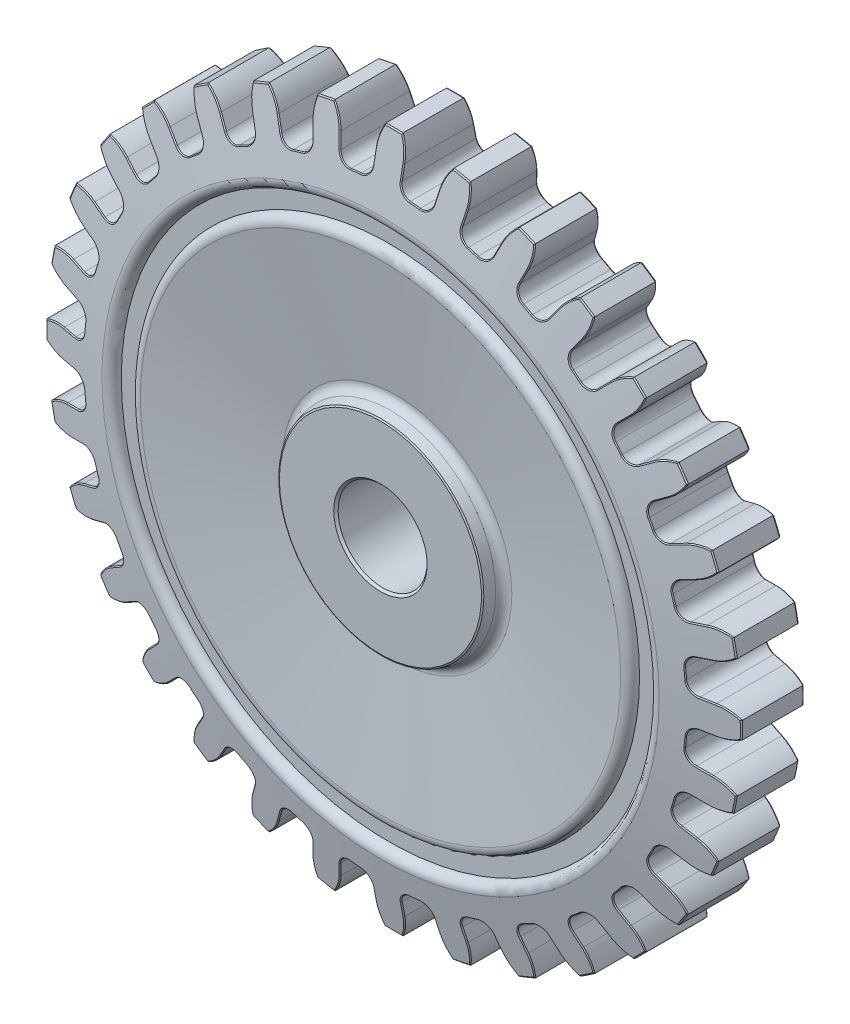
SolidWorks part; units mm, degrees
ref_plane "Спереди" through (0, 0, 0) normal (0, 0, 1) x (1, 0, 0)
ref_plane "Сверху" through (0, 0, 0) normal (0, 1, 0) x (1, 0, 0)
ref_plane "Справа" through (0, 0, 0) normal (1, 0, 0) x (0, 0, -1)
sketch "Эскиз2" plane through (0, 0, 0) normal (1, 0, 0) x (0, 0, -1)
  line L0 (-9.4803, 0) -> (8.8412, 0) construction
  line L1 (-5, 5) -> (5, 5)
  line L2 (5, 5) -> (5, 11.5)
  line L3 (-3.5, 39.1) -> (3.5, 39.1)
  line L4 (0, 0) -> (0, 39.1) construction
  line L5 (4, 30.1255) -> (4, 28.1255)
  line L6 (5, 11.5) -> (5, 38.75) construction
  line L7 (3.5, 39.1) -> (4.9824, 31.3125)
  line L8 (5, 11.5) -> (3.8613, 11.8158)
  line L9 (4.9914, 26.995) -> (3.1371, 12.9099)
  line L10 (-5, 5) -> (-5, 11.5)
  line L11 (-5, 11.5) -> (-3.8613, 11.8158)
  line L12 (-4.9914, 26.995) -> (-3.1371, 12.9099)
  line L13 (-4, 30.1255) -> (-4, 28.1255)
  line L14 (-3.5, 39.1) -> (-4.9824, 31.3125)
  arc A0 (4, 30.1255) -> (4.9824, 31.3125) centre (4, 31.1255) ccw
  arc A1 (4.9914, 26.995) -> (4, 28.1255) centre (4, 27.1255) ccw
  arc A2 (3.1371, 12.9099) -> (3.8613, 11.8158) centre (4.1286, 12.7794) ccw
  arc A3 (-3.1371, 12.9099) -> (-3.8613, 11.8158) centre (-4.1286, 12.7794) cw
  arc A4 (-4.9914, 26.995) -> (-4, 28.1255) centre (-4, 27.1255) cw
  arc A5 (-4, 30.1255) -> (-4.9824, 31.3125) centre (-4, 31.1255) cw
  point P19 (0, 5)
  dimension "D8" = 2
  dimension "D1" = 5
  dimension "D2" = 11.5
  dimension "D3" = 5
  dimension "D4" = 39.1
  dimension "D5" = 3.5
  dimension "D6" = 2
  dimension "D7" = 30.1255
  dimension "D9" = 4
  dimension "D10" = 15.5
  dimension "D11" = 7.5
  dimension "D12" = 12.7794
revolve "Повернуть1" add sketch "Эскиз2" angle 360 about L0
sketch "Эскиз3" plane through (0, 0, 0) normal (0, 0, 1) x (1, 0, 0)
  line L0 (0, 42.1478) -> (0, 0) construction
  line L2 (1.6, 36.6426) -> (1.6, 35.0778)
  line L3 (-1.6, 36.6426) -> (-1.6, 35.0778)
  line L4 (8.7179, 35.6264) -> (8.4126, 34.0916)
  line L5 (5.5794, 36.2507) -> (5.2741, 34.7159)
  line L6 (15.5007, 33.2411) -> (14.9019, 31.7954)
  line L7 (12.5443, 34.4656) -> (11.9455, 33.0199)
  line L8 (21.6879, 29.5783) -> (20.8185, 28.2772)
  line L9 (19.0272, 31.3561) -> (18.1578, 30.055)
  line L10 (27.0416, 24.7789) -> (25.9351, 23.6724)
  line L11 (24.7789, 27.0416) -> (23.6724, 25.9351)
  line L12 (31.3561, 19.0272) -> (30.055, 18.1578)
  line L13 (29.5783, 21.6879) -> (28.2772, 20.8185)
  line L14 (34.4656, 12.5443) -> (33.0199, 11.9455)
  line L15 (33.2411, 15.5007) -> (31.7954, 14.9019)
  line L16 (36.2507, 5.5794) -> (34.7159, 5.2741)
  line L17 (35.6264, 8.7179) -> (34.0916, 8.4126)
  line L18 (36.6426, -1.6) -> (35.0778, -1.6)
  line L19 (36.6426, 1.6) -> (35.0778, 1.6)
  line L20 (35.6264, -8.7179) -> (34.0916, -8.4126)
  line L21 (36.2507, -5.5794) -> (34.7159, -5.2741)
  line L22 (33.2411, -15.5007) -> (31.7954, -14.9019)
  line L23 (34.4656, -12.5443) -> (33.0199, -11.9455)
  line L24 (29.5783, -21.6879) -> (28.2772, -20.8185)
  line L25 (31.3561, -19.0272) -> (30.055, -18.1578)
  line L26 (24.7789, -27.0416) -> (23.6724, -25.9351)
  line L27 (27.0416, -24.7789) -> (25.9351, -23.6724)
  line L28 (19.0272, -31.3561) -> (18.1578, -30.055)
  line L29 (21.6879, -29.5783) -> (20.8185, -28.2772)
  line L30 (12.5443, -34.4656) -> (11.9455, -33.0199)
  line L31 (15.5007, -33.2411) -> (14.9019, -31.7954)
  line L32 (5.5794, -36.2507) -> (5.2741, -34.7159)
  line L33 (8.7179, -35.6264) -> (8.4126, -34.0916)
  line L34 (-1.6, -36.6426) -> (-1.6, -35.0778)
  line L35 (1.6, -36.6426) -> (1.6, -35.0778)
  line L36 (-8.7179, -35.6264) -> (-8.4126, -34.0916)
  line L37 (-5.5794, -36.2507) -> (-5.2741, -34.7159)
  line L38 (-15.5007, -33.2411) -> (-14.9019, -31.7954)
  line L39 (-12.5443, -34.4656) -> (-11.9455, -33.0199)
  line L40 (-21.6879, -29.5783) -> (-20.8185, -28.2772)
  line L41 (-19.0272, -31.3561) -> (-18.1578, -30.055)
  line L42 (-27.0416, -24.7789) -> (-25.9351, -23.6724)
  line L43 (-24.7789, -27.0416) -> (-23.6724, -25.9351)
  line L44 (-31.3561, -19.0272) -> (-30.055, -18.1578)
  line L45 (-29.5783, -21.6879) -> (-28.2772, -20.8185)
  line L46 (-34.4656, -12.5443) -> (-33.0199, -11.9455)
  line L47 (-33.2411, -15.5007) -> (-31.7954, -14.9019)
  line L48 (-36.2507, -5.5794) -> (-34.7159, -5.2741)
  line L49 (-35.6264, -8.7179) -> (-34.0916, -8.4126)
  line L50 (-36.6426, 1.6) -> (-35.0778, 1.6)
  line L51 (-36.6426, -1.6) -> (-35.0778, -1.6)
  line L52 (-35.6264, 8.7179) -> (-34.0916, 8.4126)
  line L53 (-36.2507, 5.5794) -> (-34.7159, 5.2741)
  line L54 (-33.2411, 15.5007) -> (-31.7954, 14.9019)
  line L55 (-34.4656, 12.5443) -> (-33.0199, 11.9455)
  line L56 (-29.5783, 21.6879) -> (-28.2772, 20.8185)
  line L57 (-31.3561, 19.0272) -> (-30.055, 18.1578)
  line L58 (-24.7789, 27.0416) -> (-23.6724, 25.9351)
  line L59 (-27.0416, 24.7789) -> (-25.9351, 23.6724)
  line L60 (-19.0272, 31.3561) -> (-18.1578, 30.055)
  line L61 (-21.6879, 29.5783) -> (-20.8185, 28.2772)
  line L62 (-12.5443, 34.4656) -> (-11.9455, 33.0199)
  line L63 (-15.5007, 33.2411) -> (-14.9019, 31.7954)
  line L64 (-5.5794, 36.2507) -> (-5.2741, 34.7159)
  line L65 (-8.7179, 35.6264) -> (-8.4126, 34.0916)
  circle A0 centre (0, 0) radius 36.8 construction
  arc A1 (-9.3097, 32.6226) -> (-10.3834, 32.2969) centre (0, 0) ccw
  circle A2 centre (0, 0) radius 39.1 construction
  arc A3 (0.9611, 39.0882) -> (1.6, 36.6426) centre (-3.4, 36.6426) cw
  arc A4 (0.9611, 39.0882) -> (-0.9611, 39.0882) centre (0, 0) ccw
  arc A5 (-0.9611, 39.0882) -> (-1.6, 36.6426) centre (3.4, 36.6426) ccw
  arc A6 (8.5683, 38.1496) -> (8.7179, 35.6264) centre (3.8139, 36.6018) cw
  arc A7 (8.5683, 38.1496) -> (6.6831, 38.5246) centre (0, 0) ccw
  arc A8 (6.6831, 38.5246) -> (5.5794, 36.2507) centre (10.4833, 35.2752) ccw
  arc A9 (15.8463, 35.745) -> (15.5007, 33.2411) centre (10.8813, 35.1545) cw
  arc A10 (15.8463, 35.745) -> (14.0705, 36.4806) centre (0, 0) ccw
  arc A11 (14.0705, 36.4806) -> (12.5443, 34.4656) centre (17.1637, 32.5522) ccw
  arc A12 (22.5153, 31.9667) -> (21.6879, 29.5783) centre (17.5305, 32.3561) cw
  arc A13 (22.5153, 31.9667) -> (20.9171, 33.0346) centre (0, 0) ccw
  arc A14 (20.9171, 33.0346) -> (19.0272, 31.3561) centre (23.1845, 28.5783) ccw
  arc A15 (28.3191, 26.9599) -> (27.0416, 24.7789) centre (23.5061, 28.3144) cw
  arc A16 (28.3191, 26.9599) -> (26.9599, 28.3191) centre (0, 0) ccw
  arc A17 (26.9599, 28.3191) -> (24.7789, 27.0416) centre (28.3144, 23.5061) ccw
  arc A18 (33.0346, 20.9171) -> (31.3561, 19.0272) centre (28.5783, 23.1845) cw
  arc A19 (33.0346, 20.9171) -> (31.9667, 22.5153) centre (0, 0) ccw
  arc A20 (31.9667, 22.5153) -> (29.5783, 21.6879) centre (32.3561, 17.5305) ccw
  arc A21 (36.4806, 14.0705) -> (34.4656, 12.5443) centre (32.5522, 17.1637) cw
  arc A22 (36.4806, 14.0705) -> (35.745, 15.8463) centre (0, 0) ccw
  arc A23 (35.745, 15.8463) -> (33.2411, 15.5007) centre (35.1545, 10.8813) ccw
  arc A24 (38.5246, 6.6831) -> (36.2507, 5.5794) centre (35.2752, 10.4833) cw
  arc A25 (38.5246, 6.6831) -> (38.1496, 8.5683) centre (0, 0) ccw
  arc A26 (38.1496, 8.5683) -> (35.6264, 8.7179) centre (36.6018, 3.8139) ccw
  arc A27 (39.0882, -0.9611) -> (36.6426, -1.6) centre (36.6426, 3.4) cw
  arc A28 (39.0882, -0.9611) -> (39.0882, 0.9611) centre (0, 0) ccw
  arc A29 (39.0882, 0.9611) -> (36.6426, 1.6) centre (36.6426, -3.4) ccw
  arc A30 (38.1496, -8.5683) -> (35.6264, -8.7179) centre (36.6018, -3.8139) cw
  arc A31 (38.1496, -8.5683) -> (38.5246, -6.6831) centre (0, 0) ccw
  arc A32 (38.5246, -6.6831) -> (36.2507, -5.5794) centre (35.2752, -10.4833) ccw
  arc A33 (35.745, -15.8463) -> (33.2411, -15.5007) centre (35.1545, -10.8813) cw
  arc A34 (35.745, -15.8463) -> (36.4806, -14.0705) centre (0, 0) ccw
  arc A35 (36.4806, -14.0705) -> (34.4656, -12.5443) centre (32.5522, -17.1637) ccw
  arc A36 (31.9667, -22.5153) -> (29.5783, -21.6879) centre (32.3561, -17.5305) cw
  arc A37 (31.9667, -22.5153) -> (33.0346, -20.9171) centre (0, 0) ccw
  arc A38 (33.0346, -20.9171) -> (31.3561, -19.0272) centre (28.5783, -23.1845) ccw
  arc A39 (26.9599, -28.3191) -> (24.7789, -27.0416) centre (28.3144, -23.5061) cw
  arc A40 (26.9599, -28.3191) -> (28.3191, -26.9599) centre (0, 0) ccw
  arc A41 (28.3191, -26.9599) -> (27.0416, -24.7789) centre (23.5061, -28.3144) ccw
  arc A42 (20.9171, -33.0346) -> (19.0272, -31.3561) centre (23.1845, -28.5783) cw
  arc A43 (20.9171, -33.0346) -> (22.5153, -31.9667) centre (0, 0) ccw
  arc A44 (22.5153, -31.9667) -> (21.6879, -29.5783) centre (17.5305, -32.3561) ccw
  arc A45 (14.0705, -36.4806) -> (12.5443, -34.4656) centre (17.1637, -32.5522) cw
  arc A46 (14.0705, -36.4806) -> (15.8463, -35.745) centre (0, 0) ccw
  arc A47 (15.8463, -35.745) -> (15.5007, -33.2411) centre (10.8813, -35.1545) ccw
  arc A48 (6.6831, -38.5246) -> (5.5794, -36.2507) centre (10.4833, -35.2752) cw
  arc A49 (6.6831, -38.5246) -> (8.5683, -38.1496) centre (0, 0) ccw
  arc A50 (8.5683, -38.1496) -> (8.7179, -35.6264) centre (3.8139, -36.6018) ccw
  arc A51 (-0.9611, -39.0882) -> (-1.6, -36.6426) centre (3.4, -36.6426) cw
  arc A52 (-0.9611, -39.0882) -> (0.9611, -39.0882) centre (0, 0) ccw
  arc A53 (0.9611, -39.0882) -> (1.6, -36.6426) centre (-3.4, -36.6426) ccw
  arc A54 (-8.5683, -38.1496) -> (-8.7179, -35.6264) centre (-3.8139, -36.6018) cw
  arc A55 (-8.5683, -38.1496) -> (-6.6831, -38.5246) centre (0, 0) ccw
  arc A56 (-6.6831, -38.5246) -> (-5.5794, -36.2507) centre (-10.4833, -35.2752) ccw
  arc A57 (-15.8463, -35.745) -> (-15.5007, -33.2411) centre (-10.8813, -35.1545) cw
  arc A58 (-15.8463, -35.745) -> (-14.0705, -36.4806) centre (0, 0) ccw
  arc A59 (-14.0705, -36.4806) -> (-12.5443, -34.4656) centre (-17.1637, -32.5522) ccw
  arc A60 (-22.5153, -31.9667) -> (-21.6879, -29.5783) centre (-17.5305, -32.3561) cw
  arc A61 (-22.5153, -31.9667) -> (-20.9171, -33.0346) centre (0, 0) ccw
  arc A62 (-20.9171, -33.0346) -> (-19.0272, -31.3561) centre (-23.1845, -28.5783) ccw
  arc A63 (-28.3191, -26.9599) -> (-27.0416, -24.7789) centre (-23.5061, -28.3144) cw
  arc A64 (-28.3191, -26.9599) -> (-26.9599, -28.3191) centre (0, 0) ccw
  arc A65 (-26.9599, -28.3191) -> (-24.7789, -27.0416) centre (-28.3144, -23.5061) ccw
  arc A66 (-33.0346, -20.9171) -> (-31.3561, -19.0272) centre (-28.5783, -23.1845) cw
  arc A67 (-33.0346, -20.9171) -> (-31.9667, -22.5153) centre (0, 0) ccw
  arc A68 (-31.9667, -22.5153) -> (-29.5783, -21.6879) centre (-32.3561, -17.5305) ccw
  arc A69 (-36.4806, -14.0705) -> (-34.4656, -12.5443) centre (-32.5522, -17.1637) cw
  arc A70 (-36.4806, -14.0705) -> (-35.745, -15.8463) centre (0, 0) ccw
  arc A71 (-35.745, -15.8463) -> (-33.2411, -15.5007) centre (-35.1545, -10.8813) ccw
  arc A72 (-38.5246, -6.6831) -> (-36.2507, -5.5794) centre (-35.2752, -10.4833) cw
  arc A73 (-38.5246, -6.6831) -> (-38.1496, -8.5683) centre (0, 0) ccw
  arc A74 (-38.1496, -8.5683) -> (-35.6264, -8.7179) centre (-36.6018, -3.8139) ccw
  arc A75 (-39.0882, 0.9611) -> (-36.6426, 1.6) centre (-36.6426, -3.4) cw
  arc A76 (-39.0882, 0.9611) -> (-39.0882, -0.9611) centre (0, 0) ccw
  arc A77 (-39.0882, -0.9611) -> (-36.6426, -1.6) centre (-36.6426, 3.4) ccw
  arc A78 (-38.1496, 8.5683) -> (-35.6264, 8.7179) centre (-36.6018, 3.8139) cw
  arc A79 (-38.1496, 8.5683) -> (-38.5246, 6.6831) centre (0, 0) ccw
  arc A80 (-38.5246, 6.6831) -> (-36.2507, 5.5794) centre (-35.2752, 10.4833) ccw
  arc A81 (-35.745, 15.8463) -> (-33.2411, 15.5007) centre (-35.1545, 10.8813) cw
  arc A82 (-35.745, 15.8463) -> (-36.4806, 14.0705) centre (0, 0) ccw
  arc A83 (-36.4806, 14.0705) -> (-34.4656, 12.5443) centre (-32.5522, 17.1637) ccw
  arc A84 (-31.9667, 22.5153) -> (-29.5783, 21.6879) centre (-32.3561, 17.5305) cw
  arc A85 (-31.9667, 22.5153) -> (-33.0346, 20.9171) centre (0, 0) ccw
  arc A86 (-33.0346, 20.9171) -> (-31.3561, 19.0272) centre (-28.5783, 23.1845) ccw
  arc A87 (-26.9599, 28.3191) -> (-24.7789, 27.0416) centre (-28.3144, 23.5061) cw
  arc A88 (-26.9599, 28.3191) -> (-28.3191, 26.9599) centre (0, 0) ccw
  arc A89 (-28.3191, 26.9599) -> (-27.0416, 24.7789) centre (-23.5061, 28.3144) ccw
  arc A90 (-20.9171, 33.0346) -> (-19.0272, 31.3561) centre (-23.1845, 28.5783) cw
  arc A91 (-20.9171, 33.0346) -> (-22.5153, 31.9667) centre (0, 0) ccw
  arc A92 (-22.5153, 31.9667) -> (-21.6879, 29.5783) centre (-17.5305, 32.3561) ccw
  arc A93 (-14.0705, 36.4806) -> (-12.5443, 34.4656) centre (-17.1637, 32.5522) cw
  arc A94 (-14.0705, 36.4806) -> (-15.8463, 35.745) centre (0, 0) ccw
  arc A95 (-15.8463, 35.745) -> (-15.5007, 33.2411) centre (-10.8813, 35.1545) ccw
  arc A96 (-6.6831, 38.5246) -> (-5.5794, 36.2507) centre (-10.4833, 35.2752) cw
  arc A97 (-6.6831, 38.5246) -> (-8.5683, 38.1496) centre (0, 0) ccw
  arc A98 (-8.5683, 38.1496) -> (-8.7179, 35.6264) centre (-3.8139, 36.6018) ccw
  arc A99 (-2.7664, 33.812) -> (-3.8831, 33.702) centre (0, 0) ccw
  arc A100 (3.8831, 33.702) -> (2.7664, 33.812) centre (0, 0) ccw
  arc A101 (10.3834, 32.2969) -> (9.3097, 32.6226) centre (0, 0) ccw
  arc A102 (16.4847, 29.6506) -> (15.4952, 30.1796) centre (0, 0) ccw
  arc A103 (21.9525, 25.8649) -> (21.0852, 26.5767) centre (0, 0) ccw
  arc A104 (26.5767, 21.0852) -> (25.8649, 21.9525) centre (0, 0) ccw
  arc A105 (30.1796, 15.4952) -> (29.6506, 16.4847) centre (0, 0) ccw
  arc A106 (32.6226, 9.3097) -> (32.2969, 10.3834) centre (0, 0) ccw
  arc A107 (33.812, 2.7664) -> (33.702, 3.8831) centre (0, 0) ccw
  arc A108 (33.702, -3.8831) -> (33.812, -2.7664) centre (0, 0) ccw
  arc A109 (32.2969, -10.3834) -> (32.6226, -9.3097) centre (0, 0) ccw
  arc A110 (29.6506, -16.4847) -> (30.1796, -15.4952) centre (0, 0) ccw
  arc A111 (25.8649, -21.9525) -> (26.5767, -21.0852) centre (0, 0) ccw
  arc A112 (21.0852, -26.5767) -> (21.9525, -25.8649) centre (0, 0) ccw
  arc A113 (15.4952, -30.1796) -> (16.4847, -29.6506) centre (0, 0) ccw
  arc A114 (9.3097, -32.6226) -> (10.3834, -32.2969) centre (0, 0) ccw
  arc A115 (2.7664, -33.812) -> (3.8831, -33.702) centre (0, 0) ccw
  arc A116 (-3.8831, -33.702) -> (-2.7664, -33.812) centre (0, 0) ccw
  arc A117 (-10.3834, -32.2969) -> (-9.3097, -32.6226) centre (0, 0) ccw
  arc A118 (-16.4847, -29.6506) -> (-15.4952, -30.1796) centre (0, 0) ccw
  arc A119 (-21.9525, -25.8649) -> (-21.0852, -26.5767) centre (0, 0) ccw
  arc A120 (-26.5767, -21.0852) -> (-25.8649, -21.9525) centre (0, 0) ccw
  arc A121 (-30.1796, -15.4952) -> (-29.6506, -16.4847) centre (0, 0) ccw
  arc A122 (-32.6226, -9.3097) -> (-32.2969, -10.3834) centre (0, 0) ccw
  arc A123 (-33.812, -2.7664) -> (-33.702, -3.8831) centre (0, 0) ccw
  arc A124 (-33.702, 3.8831) -> (-33.812, 2.7664) centre (0, 0) ccw
  arc A125 (-32.2969, 10.3834) -> (-32.6226, 9.3097) centre (0, 0) ccw
  arc A126 (-29.6506, 16.4847) -> (-30.1796, 15.4952) centre (0, 0) ccw
  arc A127 (-25.8649, 21.9525) -> (-26.5767, 21.0852) centre (0, 0) ccw
  arc A128 (-21.0852, 26.5767) -> (-21.9525, 25.8649) centre (0, 0) ccw
  arc A129 (-15.4952, 30.1796) -> (-16.4847, 29.6506) centre (0, 0) ccw
  arc A130 (20.8185, -28.2772) -> (21.0852, -26.5767) centre (21.8745, -27.5716) cw
  arc A131 (23.6724, -25.9351) -> (21.9525, -25.8649) centre (22.7743, -26.8331) ccw
  arc A132 (18.1578, -30.055) -> (16.4847, -29.6506) centre (17.1019, -30.7606) ccw
  arc A133 (14.9019, -31.7954) -> (15.4952, -30.1796) centre (16.0752, -31.3093) cw
  arc A134 (8.4126, -34.0916) -> (9.3097, -32.6226) centre (9.6582, -33.8439) cw
  arc A135 (11.9455, -33.0199) -> (10.3834, -32.2969) centre (10.7722, -33.506) ccw
  arc A136 (5.2741, -34.7159) -> (3.8831, -33.702) centre (4.0285, -34.9637) ccw
  arc A137 (1.6, -35.0778) -> (2.7664, -33.812) centre (2.87, -35.0778) cw
  arc A138 (-1.6, -35.0778) -> (-2.7664, -33.812) centre (-2.87, -35.0778) ccw
  arc A139 (-5.2741, -34.7159) -> (-3.8831, -33.702) centre (-4.0285, -34.9637) cw
  arc A140 (-8.4126, -34.0916) -> (-9.3097, -32.6226) centre (-9.6582, -33.8439) ccw
  arc A141 (-11.9455, -33.0199) -> (-10.3834, -32.2969) centre (-10.7722, -33.506) cw
  arc A142 (-14.9019, -31.7954) -> (-15.4952, -30.1796) centre (-16.0752, -31.3093) ccw
  arc A143 (-18.1578, -30.055) -> (-16.4847, -29.6506) centre (-17.1019, -30.7606) cw
  arc A144 (-20.8185, -28.2772) -> (-21.0852, -26.5767) centre (-21.8745, -27.5716) ccw
  arc A145 (-23.6724, -25.9351) -> (-21.9525, -25.8649) centre (-22.7743, -26.8331) cw
  arc A146 (-25.9351, -23.6724) -> (-25.8649, -21.9525) centre (-26.8331, -22.7743) ccw
  arc A147 (-28.2772, -20.8185) -> (-26.5767, -21.0852) centre (-27.5716, -21.8745) cw
  arc A148 (-30.055, -18.1578) -> (-29.6506, -16.4847) centre (-30.7606, -17.1019) ccw
  arc A149 (-31.7954, -14.9019) -> (-30.1796, -15.4952) centre (-31.3093, -16.0752) cw
  arc A150 (-33.0199, -11.9455) -> (-32.2969, -10.3834) centre (-33.506, -10.7722) ccw
  arc A151 (-34.0916, -8.4126) -> (-32.6226, -9.3097) centre (-33.8439, -9.6582) cw
  arc A152 (-34.7159, -5.2741) -> (-33.702, -3.8831) centre (-34.9637, -4.0285) ccw
  arc A153 (-35.0778, -1.6) -> (-33.812, -2.7664) centre (-35.0778, -2.87) cw
  arc A154 (-35.0778, 1.6) -> (-33.812, 2.7664) centre (-35.0778, 2.87) ccw
  arc A155 (-34.7159, 5.2741) -> (-33.702, 3.8831) centre (-34.9637, 4.0285) cw
  arc A156 (-34.0916, 8.4126) -> (-32.6226, 9.3097) centre (-33.8439, 9.6582) ccw
  arc A157 (-33.0199, 11.9455) -> (-32.2969, 10.3834) centre (-33.506, 10.7722) cw
  arc A158 (-31.7954, 14.9019) -> (-30.1796, 15.4952) centre (-31.3093, 16.0752) ccw
  arc A159 (-30.055, 18.1578) -> (-29.6506, 16.4847) centre (-30.7606, 17.1019) cw
  arc A160 (-28.2772, 20.8185) -> (-26.5767, 21.0852) centre (-27.5716, 21.8745) ccw
  arc A161 (-25.9351, 23.6724) -> (-25.8649, 21.9525) centre (-26.8331, 22.7743) cw
  arc A162 (-20.8185, 28.2772) -> (-21.0852, 26.5767) centre (-21.8745, 27.5716) cw
  arc A163 (-23.6724, 25.9351) -> (-21.9525, 25.8649) centre (-22.7743, 26.8331) ccw
  arc A164 (25.9351, -23.6724) -> (25.8649, -21.9525) centre (26.8331, -22.7743) cw
  arc A165 (28.2772, -20.8185) -> (26.5767, -21.0852) centre (27.5716, -21.8745) ccw
  arc A166 (30.055, -18.1578) -> (29.6506, -16.4847) centre (30.7606, -17.1019) cw
  arc A167 (31.7954, -14.9019) -> (30.1796, -15.4952) centre (31.3093, -16.0752) ccw
  arc A168 (33.0199, -11.9455) -> (32.2969, -10.3834) centre (33.506, -10.7722) cw
  arc A169 (34.0916, -8.4126) -> (32.6226, -9.3097) centre (33.8439, -9.6582) ccw
  arc A170 (34.7159, -5.2741) -> (33.702, -3.8831) centre (34.9637, -4.0285) cw
  arc A171 (35.0778, -1.6) -> (33.812, -2.7664) centre (35.0778, -2.87) ccw
  arc A172 (35.0778, 1.6) -> (33.812, 2.7664) centre (35.0778, 2.87) cw
  arc A173 (34.7159, 5.2741) -> (33.702, 3.8831) centre (34.9637, 4.0285) ccw
  arc A174 (34.0916, 8.4126) -> (32.6226, 9.3097) centre (33.8439, 9.6582) cw
  arc A175 (33.0199, 11.9455) -> (32.2969, 10.3834) centre (33.506, 10.7722) ccw
  arc A176 (31.7954, 14.9019) -> (30.1796, 15.4952) centre (31.3093, 16.0752) cw
  arc A177 (30.055, 18.1578) -> (29.6506, 16.4847) centre (30.7606, 17.1019) ccw
  arc A178 (28.2772, 20.8185) -> (26.5767, 21.0852) centre (27.5716, 21.8745) cw
  arc A179 (25.9351, 23.6724) -> (25.8649, 21.9525) centre (26.8331, 22.7743) ccw
  arc A180 (23.6724, 25.9351) -> (21.9525, 25.8649) centre (22.7743, 26.8331) cw
  arc A181 (20.8185, 28.2772) -> (21.0852, 26.5767) centre (21.8745, 27.5716) ccw
  arc A182 (18.1578, 30.055) -> (16.4847, 29.6506) centre (17.1019, 30.7606) cw
  arc A183 (14.9019, 31.7954) -> (15.4952, 30.1796) centre (16.0752, 31.3093) ccw
  arc A184 (11.9455, 33.0199) -> (10.3834, 32.2969) centre (10.7722, 33.506) cw
  arc A185 (8.4126, 34.0916) -> (9.3097, 32.6226) centre (9.6582, 33.8439) ccw
  arc A186 (1.6, 35.0778) -> (2.7664, 33.812) centre (2.87, 35.0778) ccw
  arc A187 (5.2741, 34.7159) -> (3.8831, 33.702) centre (4.0285, 34.9637) cw
  arc A188 (-18.1578, 30.055) -> (-16.4847, 29.6506) centre (-17.1019, 30.7606) ccw
  arc A189 (-14.9019, 31.7954) -> (-15.4952, 30.1796) centre (-16.0752, 31.3093) cw
  arc A190 (-11.9455, 33.0199) -> (-10.3834, 32.2969) centre (-10.7722, 33.506) ccw
  arc A191 (-8.4126, 34.0916) -> (-9.3097, 32.6226) centre (-9.6582, 33.8439) cw
  arc A192 (-5.2741, 34.7159) -> (-3.8831, 33.702) centre (-4.0285, 34.9637) ccw
  arc A193 (-2.7664, 33.812) -> (-1.6, 35.0778) centre (-2.87, 35.0778) ccw
  point P406 (1.6, 33.8872)
  point P421 (-1.6, 33.8872)
  dimension "D1" = 73.6
  dimension "D3" = 1.6
  dimension "D4" = 67.85
  dimension "D6" = 1.27
  dimension "D2" = 5
  dimension "D7" = 32
extrude "Вырез-Вытянуть1" cut sketch "Эскиз3" against normal mid plane 10 flip side to cut
chamfer "Фаска1" distance 0.25 angle 45 2 edges at (5, 0, 5) (5, 0, -5)
chamfer "Фаска2" distance 0.1 angle 45 400 edges at (21.7228, -32.5105, -3.5) (22.0951, -30.3153, -3.8021) (20.6103, -27.45, -4.4087) (21.5218, -26.2244, -4.4851) (22.723, -25.5642, -4.4321) (26.1691, -28.0225, -3.6444) (27.6479, -27.6479, -3.5) (27.5847, -25.4222, -3.8021) (25.5695, -22.9017, -4.4087) (26.2244, -21.5218, -4.4851) (27.2737, -20.6399, -4.4321) (31.1333, -22.3787, -3.6443) (32.5105, -21.7228, -3.5) (32.0143, -19.5523, -3.8021) (29.5461, -17.4732, -4.4087) (29.9192, -15.9921, -4.4851) (30.7763, -14.9225, -4.4321) (34.9009, -15.8749, -3.6443) (36.1237, -14.9629, -3.5) (35.2137, -12.9309, -3.8021) (32.3872, -11.3733, -4.4087) (32.4642, -9.8479, -4.4851) (33.0962, -8.6316, -4.4321) (37.3274, -8.761, -3.6443) (38.3487, -7.628, -3.5) (37.0597, -5.8126, -3.8021) (33.9837, -4.8363, -4.4087) (33.7616, -3.3252, -4.4851) (34.1442, -2.009, -4.4321) (38.3193, -1.3105, -3.6443) (39.1, 0, -3.5) (37.4816, 1.5291, -3.8021) (34.2743, 1.8865, -4.4087) (33.7616, 3.3252, -4.4851) (33.8801, 4.6908, -4.4321) (37.8387, 6.1904, -3.6443) (38.3487, 7.628, -3.5) (36.4631, 8.812, -3.8021) (33.2477, 8.5368, -4.4087) (32.4642, 9.8479, -4.4851) (32.3139, 11.2104, -4.4321) (35.9039, 13.4534, -3.6443) (36.1237, 14.9629, -3.5) (34.0433, 15.7563, -3.8021) (30.9434, 14.8591, -4.4087) (29.9192, 15.9921, -4.4851) (29.506, 17.2991, -4.4321) (32.5894, 20.1994, -3.6443) (32.5105, 21.7228, -3.5) (30.3153, 22.0951, -3.8021) (27.45, 20.6103, -4.4087) (26.2244, 21.5218, -4.4851) (25.5642, 22.723, -4.4321) (28.0225, 26.1691, -3.6444) (27.6479, 27.6479, -3.5) (25.4222, 27.5847, -3.8021) (22.9017, 25.5695, -4.4087) (21.5218, 26.2244, -4.4851) (20.6399, 27.2737, -4.4321) (22.3787, 31.1333, -3.6443) (21.7228, 32.5105, -3.5) (19.5523, 32.0143, -3.8021) (17.4732, 29.5461, -4.4087) (15.9921, 29.9192, -4.4851) (14.9225, 30.7763, -4.4321) (15.8749, 34.9009, -3.6443) (14.9629, 36.1237, -3.5) (12.9309, 35.2137, -3.8021) (11.3733, 32.3872, -4.4087) (9.8479, 32.4642, -4.4851) (8.6316, 33.0962, -4.4321) (8.761, 37.3274, -3.6443) (7.628, 38.3487, -3.5) (5.8126, 37.0597, -3.8021) (4.8363, 33.9837, -4.4087) (3.3252, 33.7616, -4.4851) (2.009, 34.1442, -4.4321) (1.3105, 38.3193, -3.6443) (0, 39.1, -3.5) (-1.5291, 37.4816, -3.8021) (-1.8865, 34.2743, -4.4087) (-3.3252, 33.7616, -4.4851) (-4.6908, 33.8801, -4.4321) (-6.1904, 37.8387, -3.6443) (-7.628, 38.3487, -3.5) (-8.812, 36.4631, -3.8021) (-8.5368, 33.2477, -4.4087) (-9.8479, 32.4642, -4.4851) (-11.2104, 32.3139, -4.4321) (-13.4534, 35.9039, -3.6443) (-14.9629, 36.1237, -3.5) (-15.7563, 34.0433, -3.8021) (-14.8591, 30.9434, -4.4087) (-15.9921, 29.9192, -4.4851) (-17.2991, 29.506, -4.4321) (-20.1994, 32.5894, -3.6443) (-21.7228, 32.5105, -3.5) (-22.0951, 30.3153, -3.8021) (-20.6103, 27.45, -4.4087) (-21.5218, 26.2244, -4.4851) (-22.723, 25.5642, -4.4321) (-26.1691, 28.0225, -3.6444) (-27.6479, 27.6479, -3.5) (-27.5847, 25.4222, -3.8021) (-25.5695, 22.9017, -4.4087) (-26.2244, 21.5218, -4.4851) (-27.2737, 20.6399, -4.4321) (-31.1333, 22.3787, -3.6443) (-32.5105, 21.7228, -3.5) (-32.0143, 19.5523, -3.8021) (-29.5461, 17.4732, -4.4087) (-29.9192, 15.9921, -4.4851) (-30.7763, 14.9225, -4.4321) (-34.9009, 15.8749, -3.6443) (-36.1237, 14.9629, -3.5) (-35.2137, 12.9309, -3.8021) (-32.3872, 11.3733, -4.4087) (-32.4642, 9.8479, -4.4851) (-33.0962, 8.6316, -4.4321) (-37.3274, 8.761, -3.6443) (-38.3487, 7.628, -3.5) (-37.0597, 5.8126, -3.8021) (-33.9837, 4.8363, -4.4087) (-33.7616, 3.3252, -4.4851) (-34.1442, 2.009, -4.4321) (-38.3193, 1.3105, -3.6443) (-39.1, 0, -3.5) (-37.4816, -1.5291, -3.8021) (-34.2743, -1.8865, -4.4087) (-33.7616, -3.3252, -4.4851) (-33.8801, -4.6908, -4.4321) (-37.8387, -6.1904, -3.6443) (-38.3487, -7.628, -3.5) (-36.4631, -8.812, -3.8021) (-33.2477, -8.5368, -4.4087) (-32.4642, -9.8479, -4.4851) (-32.3139, -11.2104, -4.4321) (-35.9039, -13.4534, -3.6443) (-36.1237, -14.9629, -3.5) (-34.0433, -15.7563, -3.8021) (-30.9434, -14.8591, -4.4087) (-29.9192, -15.9921, -4.4851) (-29.506, -17.2991, -4.4321) (-32.5894, -20.1994, -3.6443) (-32.5105, -21.7228, -3.5) (-30.3153, -22.0951, -3.8021) (-27.45, -20.6103, -4.4087) (-26.2244, -21.5218, -4.4851) (-25.5642, -22.723, -4.4321) (-28.0225, -26.1691, -3.6444) (-27.6479, -27.6479, -3.5) (-25.4222, -27.5847, -3.8021) (-22.9017, -25.5695, -4.4087) (-21.5218, -26.2244, -4.4851) (-20.6399, -27.2737, -4.4321) (-22.3787, -31.1333, -3.6443) (-21.7228, -32.5105, -3.5) (-19.5523, -32.0143, -3.8021) (-17.4732, -29.5461, -4.4087) (-15.9921, -29.9192, -4.4851) (-14.9225, -30.7763, -4.4321) (-15.8749, -34.9009, -3.6443) (-14.9629, -36.1237, -3.5) (-12.9309, -35.2137, -3.8021) (-11.3733, -32.3872, -4.4087) (-9.8479, -32.4642, -4.4851) (-8.6316, -33.0962, -4.4321) (-8.761, -37.3274, -3.6443) (-7.628, -38.3487, -3.5) (-5.8126, -37.0597, -3.8021) (-4.8363, -33.9837, -4.4087) (-3.3252, -33.7616, -4.4851) (-2.009, -34.1442, -4.4321) (-1.3105, -38.3193, -3.6443) (0, -39.1, -3.5) (1.5291, -37.4816, -3.8021) (1.8865, -34.2743, -4.4087) (3.3252, -33.7616, -4.4851) (4.6908, -33.8801, -4.4321) (6.1904, -37.8387, -3.6443) (7.628, -38.3487, -3.5) (8.812, -36.4631, -3.8021) (8.5368, -33.2477, -4.4087) (9.8479, -32.4642, -4.4851) (11.2104, -32.3139, -4.4321) (13.4534, -35.9039, -3.6443) (14.9629, -36.1237, -3.5) (15.7563, -34.0433, -3.8021) (14.8591, -30.9434, -4.4087) (15.9921, -29.9192, -4.4851) (17.2991, -29.506, -4.4321) (20.1994, -32.5894, -3.6443) (14.9629, -36.1237, 3.5) (12.9309, -35.2137, 3.8021) (11.3733, -32.3872, 4.4087) (9.8479, -32.4642, 4.4851) (8.6316, -33.0962, 4.4321) (8.761, -37.3274, 3.6443) (7.628, -38.3487, 3.5) (5.8126, -37.0597, 3.8021) (4.8363, -33.9837, 4.4087) (3.3252, -33.7616, 4.4851) (2.009, -34.1442, 4.4321) (1.3105, -38.3193, 3.6443) (0, -39.1, 3.5) (-1.5291, -37.4816, 3.8021) (-1.8865, -34.2743, 4.4087) (-3.3252, -33.7616, 4.4851) (-4.6908, -33.8801, 4.4321) (-6.1904, -37.8387, 3.6443) (-7.628, -38.3487, 3.5) (-8.812, -36.4631, 3.8021) (-8.5368, -33.2477, 4.4087) (-9.8479, -32.4642, 4.4851) (-11.2104, -32.3139, 4.4321) (-13.4534, -35.9039, 3.6443) (-14.9629, -36.1237, 3.5) (-15.7563, -34.0433, 3.8021) (-14.8591, -30.9434, 4.4087) (-15.9921, -29.9192, 4.4851) (-17.2991, -29.506, 4.4321) (-20.1994, -32.5894, 3.6443) (-21.7228, -32.5105, 3.5) (-22.0951, -30.3153, 3.8021) (-20.6103, -27.45, 4.4087) (-21.5218, -26.2244, 4.4851) (-22.723, -25.5642, 4.4321) (-26.1691, -28.0225, 3.6444) (-27.6479, -27.6479, 3.5) (-27.5847, -25.4222, 3.8021) (-25.5695, -22.9017, 4.4087) (-26.2244, -21.5218, 4.4851) (-27.2737, -20.6399, 4.4321) (-31.1333, -22.3787, 3.6443) (-32.5105, -21.7228, 3.5) (-32.0143, -19.5523, 3.8021) (-29.5461, -17.4732, 4.4087) (-29.9192, -15.9921, 4.4851) (-30.7763, -14.9225, 4.4321) (-34.9009, -15.8749, 3.6443) (-36.1237, -14.9629, 3.5) (-35.2137, -12.9309, 3.8021) (-32.3872, -11.3733, 4.4087) (-32.4642, -9.8479, 4.4851) (-33.0962, -8.6316, 4.4321) (-37.3274, -8.761, 3.6443) (-38.3487, -7.628, 3.5) (-37.0597, -5.8126, 3.8021) (-33.9837, -4.8363, 4.4087) (-33.7616, -3.3252, 4.4851) (-34.1442, -2.009, 4.4321) (-38.3193, -1.3105, 3.6443) (-39.1, 0, 3.5) (-37.4816, 1.5291, 3.8021) (-34.2743, 1.8865, 4.4087) (-33.7616, 3.3252, 4.4851) (-33.8801, 4.6908, 4.4321) (-37.8387, 6.1904, 3.6443) (-38.3487, 7.628, 3.5) (-36.4631, 8.812, 3.8021) (-33.2477, 8.5368, 4.4087) (-32.4642, 9.8479, 4.4851) (-32.3139, 11.2104, 4.4321) (-35.9039, 13.4534, 3.6443) (-36.1237, 14.9629, 3.5) (-34.0433, 15.7563, 3.8021) (-30.9434, 14.8591, 4.4087) (-29.9192, 15.9921, 4.4851) (-29.506, 17.2991, 4.4321) (-32.5894, 20.1994, 3.6443) (-32.5105, 21.7228, 3.5) (-30.3153, 22.0951, 3.8021) (-27.45, 20.6103, 4.4087) (-26.2244, 21.5218, 4.4851) (-25.5642, 22.723, 4.4321) (-28.0225, 26.1691, 3.6444) (-27.6479, 27.6479, 3.5) (-25.4222, 27.5847, 3.8021) (-22.9017, 25.5695, 4.4087) (-21.5218, 26.2244, 4.4851) (-20.6399, 27.2737, 4.4321) (-22.3787, 31.1333, 3.6443) (-21.7228, 32.5105, 3.5) (-19.5523, 32.0143, 3.8021) (-17.4732, 29.5461, 4.4087) (-15.9921, 29.9192, 4.4851) (-14.9225, 30.7763, 4.4321) (-15.8749, 34.9009, 3.6443) (-14.9629, 36.1237, 3.5) (-12.9309, 35.2137, 3.8021) (-11.3733, 32.3872, 4.4087) (-9.8479, 32.4642, 4.4851) (-8.6316, 33.0962, 4.4321) (-8.761, 37.3274, 3.6443) (-7.628, 38.3487, 3.5) (-5.8126, 37.0597, 3.8021) (-4.8363, 33.9837, 4.4087) (-3.3252, 33.7616, 4.4851) (-2.009, 34.1442, 4.4321) (-1.3105, 38.3193, 3.6443)
